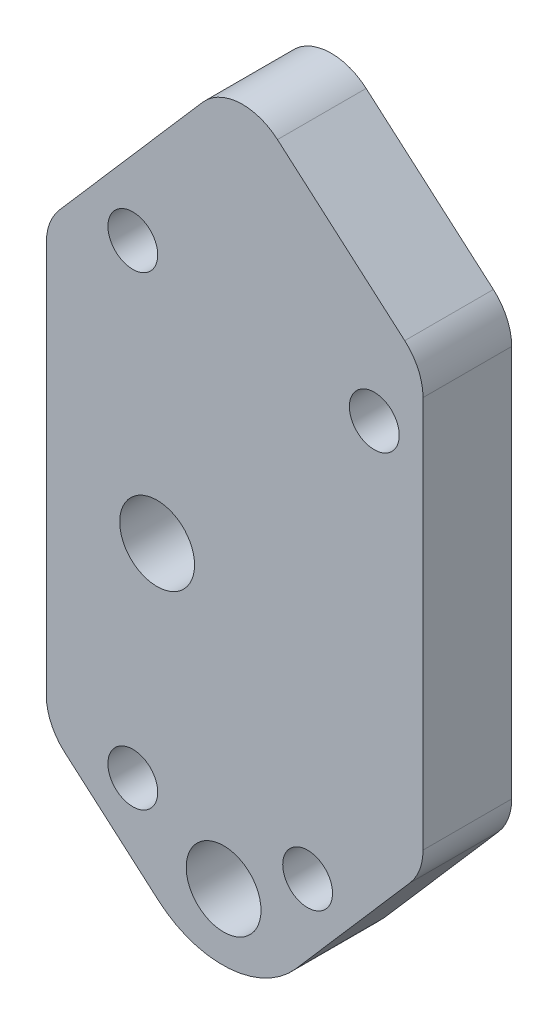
SolidWorks part; units mm, degrees
ref_plane "Front" through (0, 0, 0) normal (0, 0, 1) x (1, 0, 0)
ref_plane "Top" through (0, 0, 0) normal (0, 1, 0) x (1, 0, 0)
ref_plane "Right" through (0, 0, 0) normal (1, 0, 0) x (0, 0, -1)
ref_plane "Plane1"
sketch "Sketch1" plane through (0, 0, 71.9582) normal (0, 0, -1) x (-1, 0, 0)
  line L96 (777.7097, -55.7498) -> (794.0493, -74.565)
  line L97 (813.757, -75.9528) -> (827.1944, -64.2834)
  line L98 (829.818, -58.5301) -> (829.818, -2.3863)
  line L99 (827.9513, 2.6101) -> (807.4481, 26.2197)
  line L100 (796.6984, 26.9766) -> (778.4666, 11.1437)
  line L101 (775.843, 5.3903) -> (775.843, -50.7535)
  line L102 (777.7097, -55.7498) -> (794.0493, -74.565)
  line L103 (813.757, -75.9528) -> (827.1944, -64.2834)
  line L104 (829.818, -58.5301) -> (829.818, -2.3863)
  line L105 (827.9513, 2.6101) -> (807.4481, 26.2197)
  line L106 (796.6984, 26.9766) -> (778.4666, 11.1437)
  line L107 (775.843, 5.3903) -> (775.843, -50.7535)
  arc A96 (794.0493, -74.565) -> (813.757, -75.9528) centre (804.5971, -65.405) ccw
  arc A97 (827.1944, -64.2834) -> (829.818, -58.5301) centre (822.198, -58.5301) ccw
  arc A98 (829.818, -2.3863) -> (827.9513, 2.6101) centre (822.198, -2.3863) ccw
  arc A99 (807.4481, 26.2197) -> (796.6984, 26.9766) centre (801.6947, 21.2233) ccw
  arc A100 (778.4666, 11.1437) -> (775.843, 5.3903) centre (783.463, 5.3903) ccw
  arc A101 (775.843, -50.7535) -> (777.7097, -55.7498) centre (783.463, -50.7535) ccw
  arc A102 (794.0493, -74.565) -> (813.757, -75.9528) centre (804.5971, -65.405) ccw
  arc A103 (827.1944, -64.2834) -> (829.818, -58.5301) centre (822.198, -58.5301) ccw
  arc A104 (829.818, -2.3863) -> (827.9513, 2.6101) centre (822.198, -2.3863) ccw
  arc A105 (807.4481, 26.2197) -> (796.6984, 26.9766) centre (801.6947, 21.2233) ccw
  arc A106 (778.4666, 11.1437) -> (775.843, 5.3903) centre (783.463, 5.3903) ccw
  arc A107 (775.843, -50.7535) -> (777.7097, -55.7498) centre (783.463, -50.7535) ccw
extrude "Boss-Extrude1" add sketch "Sketch1" against normal blind 12.7 flip side to cut
hole_wizard "Hole1" positions "Point_Sketch" profile "Profil_Sketch" hole size "Ø0.15" standard "ISO"
sketch "Point_Sketch" plane through (-798.7005, -36.6401, 71.9582) normal (0, 0, 1) x (-1, 0, 0)
  point P0 (3.6543, 10.6011)
  point P2 (-1.9225, 4.5369)
sketch "Profil_Sketch" plane through (-802.3548, -47.2413, 71.9582) normal (1, 0, 0) x (0, 1, 0)
  line L0 (0, 0) -> (0, 10.16)
  line L1 (0, 10.16) -> (0.0005, 10.16)
  line L2 (0.0005, 10.16) -> (0.0005, 0)
  line L5 (0.0005, 0) -> (0, 0)
  line L11 (0, -6.35) -> (0, 107.95) construction
  dimension "Diameter" = 0.001
  dimension "Thru Hole Depth" = 10.16
other "usin_Temp_Suppressed<1>"
hole_wizard "Hole11" positions "Point_Sketch1" profile "Profil_Sketch1" hole size "Ø0.15" standard "ISO"
sketch "Point_Sketch1" plane through (-785.5665, -14.9521, 71.9582) normal (0, 0, 1) x (-1, 0, 0)
  point P0 (3.6543, 10.6011)
sketch "Profil_Sketch1" plane through (-789.2208, -25.5532, 71.9582) normal (1, 0, 0) x (0, 1, 0)
  line L0 (0, 0) -> (0, 10.16)
  line L1 (0, 10.16) -> (0.0005, 10.16)
  line L2 (0.0005, 10.16) -> (0.0005, 0)
  line L5 (0.0005, 0) -> (0, 0)
  line L11 (0, -6.35) -> (0, 107.95) construction
  dimension "Diameter" = 0.001
  dimension "Thru Hole Depth" = 10.16
other "usin_Temp_Suppressed<2>"
hole_wizard "Hole12" positions "Point_Sketch2" profile "Profil_Sketch2" hole size "Ø0.15" standard "ISO"
sketch "Point_Sketch2" plane through (-803.1061, -11.0849, 71.9582) normal (0, 0, 1) x (-1, 0, 0)
  point P0 (3.6543, 10.6011)
sketch "Profil_Sketch2" plane through (-806.7604, -21.6861, 71.9582) normal (1, 0, 0) x (0, 1, 0)
  line L0 (0, 0) -> (0, 10.16)
  line L1 (0, 10.16) -> (0.0005, 10.16)
  line L2 (0.0005, 10.16) -> (0.0005, 0)
  line L5 (0.0005, 0) -> (0, 0)
  line L11 (0, -6.35) -> (0, 107.95) construction
  dimension "Diameter" = 0.001
  dimension "Thru Hole Depth" = 10.16
other "usin_Temp_Suppressed<3>"
hole_wizard "Hole13" positions "Point_Sketch3" profile "Profil_Sketch3" hole size "Ø0.15" standard "ISO"
sketch "Point_Sketch3" plane through (-780.4437, 10.0429, 71.9582) normal (0, 0, 1) x (-1, 0, 0)
  point P0 (2.3843, 11.0446)
  point P2 (36.9813, 5.9646)
  point P4 (11.9344, 72.6396)
  point P6 (36.9813, 72.6396)
sketch "Profil_Sketch3" plane through (-782.828, -1.0017, 71.9582) normal (1, 0, 0) x (0, 1, 0)
  line L0 (0, 0) -> (0, 12.7)
  line L1 (0, 12.7) -> (3.5687, 12.7)
  line L2 (3.5687, 12.7) -> (3.5687, 0)
  line L5 (3.5687, 0) -> (0, 0)
  line L11 (0, -6.35) -> (0, 107.95) construction
  dimension "Diameter" = 7.1374
  dimension "Thru Hole Depth" = 12.7
other "usin_DL090_.25-20x1.75-SHCS<1>"
hole_wizard "Hole14" positions "Point_Sketch4" profile "Profil_Sketch4" counterbore size "1/4" standard "ANSI Inch"
sketch "Point_Sketch4" plane through (-817.2871, -68.9114, 84.6582) normal (0, 0, -1) x (1, 0, 0)
  point P0 (12.8691, 0.935)
  point P2 (3.3441, -37.1614)
sketch "Profil_Sketch4" plane through (-804.418, -69.8464, 84.6582) normal (1, 0, 0) x (0, -1, 0)
  line L0 (0, 0) -> (0, 12.7)
  line L1 (0, 12.7) -> (3.5687, 12.7)
  line L3 (3.5687, 12.7) -> (3.5687, 7.874)
  line L4 (3.5687, 7.874) -> (5.3594, 7.874)
  line L5 (5.3594, 7.874) -> (5.3594, 0)
  line L7 (5.3594, 0) -> (0, 0)
  line L11 (0, -6.35) -> (0, 107.95) construction
  dimension "Diameter" = 7.1374
  dimension "Thru Hole Depth" = 12.7
  dimension "L1" = 7.874
other "usin_LS160_.25-20x.625-SHCS<1>"
